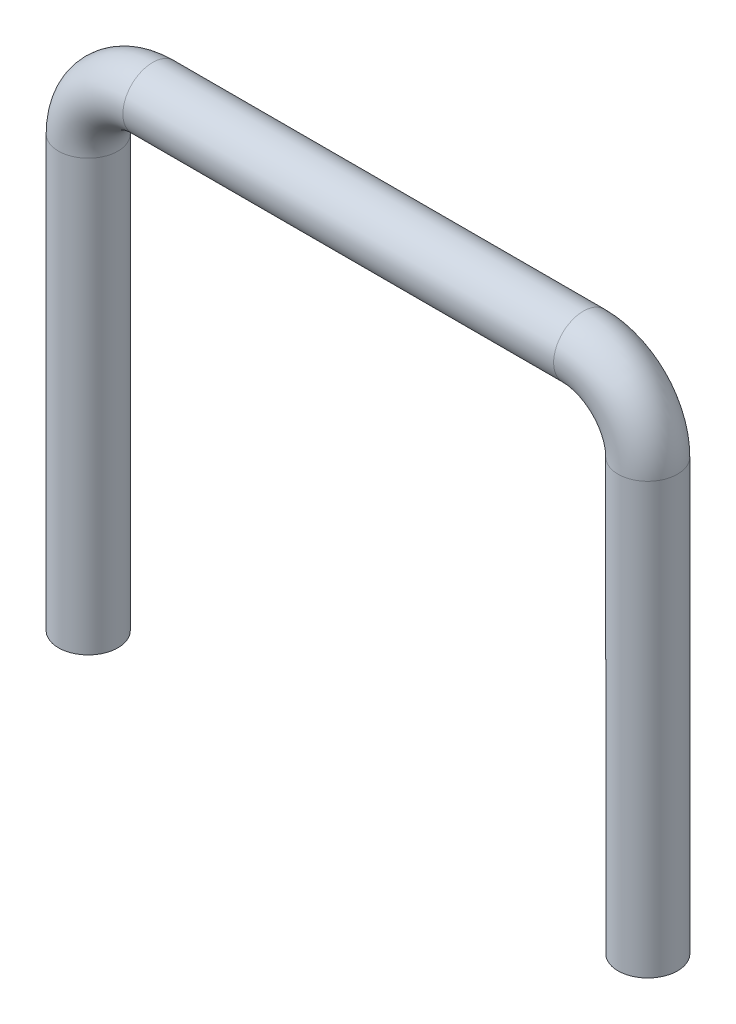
SolidWorks part; units mm, degrees
ref_plane "Plan1" through (0, 0, 0) normal (0, 0, 1) x (1, 0, 0)
ref_plane "Plan2" through (0, 0, 0) normal (0, 1, 0) x (1, 0, 0)
ref_plane "Plan3" through (0, 0, 0) normal (1, 0, 0) x (0, 0, -1)
sketch "Esquisse1" plane through (0, 0, 0) normal (0, 0, 1) x (1, 0, 0)
  line L0 (0, 0) -> (0, 434)
  line L1 (65, 499) -> (499.55, 499)
  line L2 (564.55, 434) -> (564.55, 0)
  arc A0 (499.55, 499) -> (564.55, 434) centre (499.55, 434) cw
  arc A1 (0, 434) -> (65, 499) centre (65, 434) cw
  point P7 (564.55, 499)
  point P10 (0, 499)
  dimension "D3" = 65
  dimension "D4" = 65
  dimension "D1" = 564.55
  dimension "D2" = 499
sketch "Esquisse2" plane through (0, 0, 0) normal (0, 1, 0) x (1, 0, 0)
  circle A0 centre (0, 0) radius 6
  circle A1 centre (0, 0) radius 30
  dimension "D1" = 12
  dimension "D2" = 60
sweep "Base-Balayage" add profiles "Esquisse2" path "Esquisse1"
